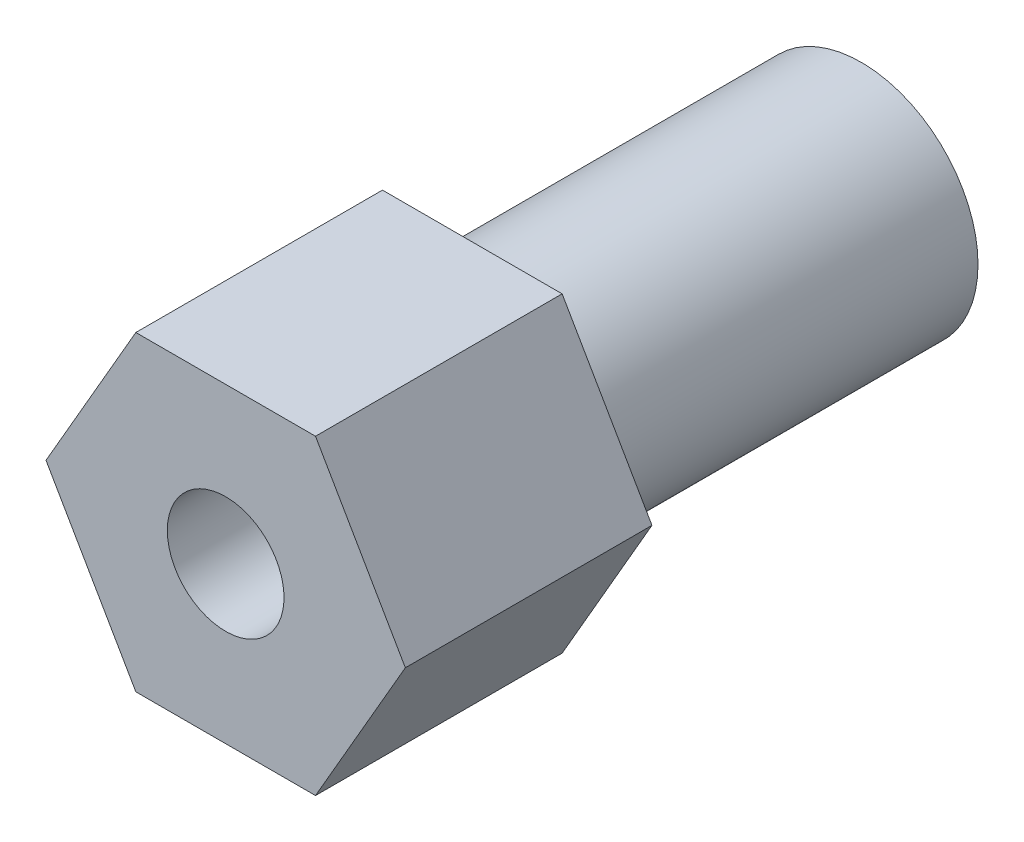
SolidWorks part; units mm, degrees
ref_plane "Front" through (0, 0, 0) normal (0, 0, 1) x (1, 0, 0)
ref_plane "Top" through (0, 0, 0) normal (0, 1, 0) x (1, 0, 0)
ref_plane "Right" through (0, 0, 0) normal (1, 0, 0) x (0, 0, -1)
sketch "Sketch1" plane through (0, 0, 0) normal (0, 0, 1) x (1, 0, 0)
  line L1 (2.3094, -4) -> (4.6188, 0)
  line L2 (4.6188, 0) -> (2.3094, 4)
  line L3 (2.3094, 4) -> (-2.3094, 4)
  line L4 (-2.3094, 4) -> (-4.6188, 0)
  line L5 (-4.6188, 0) -> (-2.3094, -4)
  line L6 (-2.3094, -4) -> (2.3094, -4)
  circle A0 centre (0, 0) radius 4 construction
  dimension "D1" = 8
extrude "Extrude1" add sketch "Sketch1" along normal blind 6.34
sketch "Sketch2" plane through (0, 0, 0) normal (0, 0, -1) x (-1, 0, 0)
  circle A0 centre (0, 0) radius 3
  dimension "D1" = 6
extrude "Extrude2" add sketch "Sketch2" along normal blind 10
sketch "Sketch3" plane through (0, 0, -10) normal (0, 0, -1) x (-1, 0, 0)
  circle A0 centre (0, 0) radius 1.5
  dimension "D1" = 3
extrude "Cut-Extrude1" cut sketch "Sketch3" against normal through all
